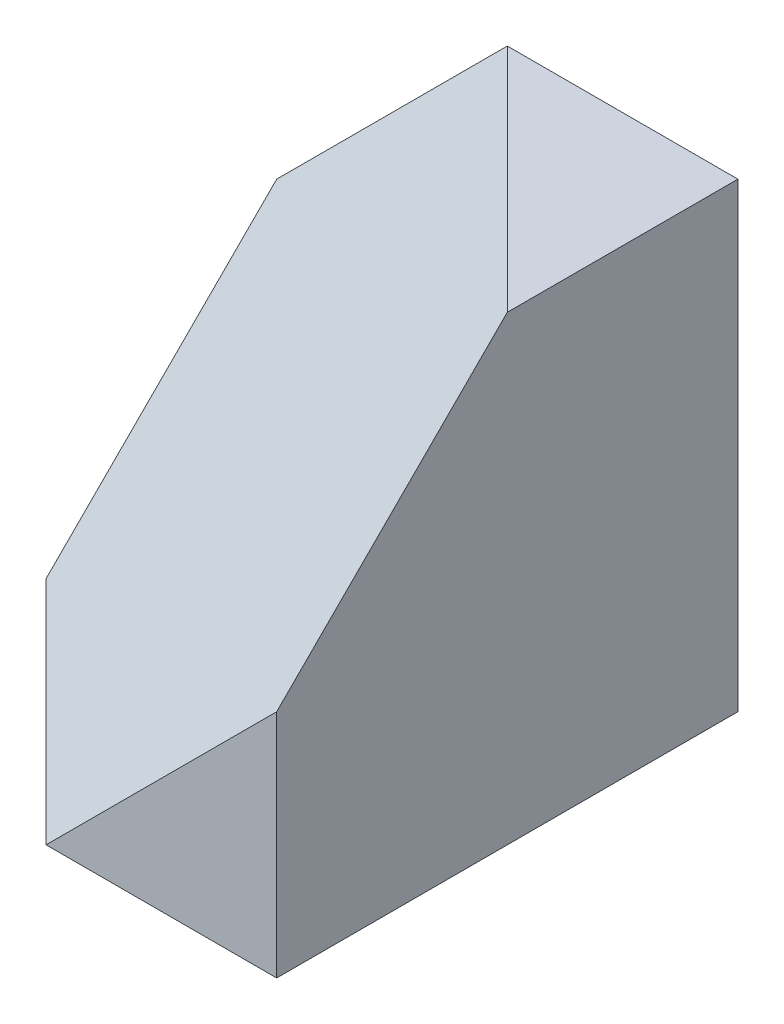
SolidWorks part; units mm, degrees
ref_plane "正面" through (0, 0, 0) normal (0, 0, 1) x (1, 0, 0)
ref_plane "平面" through (0, 0, 0) normal (0, 1, 0) x (1, 0, 0)
ref_plane "右側面" through (0, 0, 0) normal (1, 0, 0) x (0, 0, -1)
sketch "ｽｹｯﾁ1" plane through (0, 0, 0) normal (0, 0, 1) x (1, 0, 0)
  line L1 (0, 0) -> (10, 0)
  line L2 (0, 0) -> (0, 10)
  line L3 (0, 10) -> (10, 10)
  line L4 (10, 0) -> (10, 10)
  dimension "D1" = 10
  dimension "D2" = 10
extrude "ﾎﾞｽ - 押し出し1" add sketch "ｽｹｯﾁ1" against normal blind 10
ref_plane "正六角形の断面を作る平面" through (1.6667, -1.6667, -1.6667) normal (0.5774, -0.5774, -0.5774) x (-0.8165, -0.4082, -0.4082)
other "ｻｰﾌｪｽ ｶｯﾄ1"
sketch "ｽｹｯﾁ2" plane through (1.6667, -1.6667, -1.6667) normal (0.5774, -0.5774, -0.5774) x (-0.8165, -0.4082, -0.4082)
  line L1 (1.1774, 9.1931) -> (-9.6541, 9.1931)
  line L2 (1.1774, 9.1931) -> (1.1774, 6.0059)
  line L3 (1.1774, 6.0059) -> (-9.6541, 6.0059)
  line L4 (-9.6541, 9.1931) -> (-9.6541, 6.0059)
  circle A0 centre (-1.7291, 4.4076) radius 1.1191
  text T0 "ここに  スケッチを描く" font "ＭＳ ゴシック" height 1
